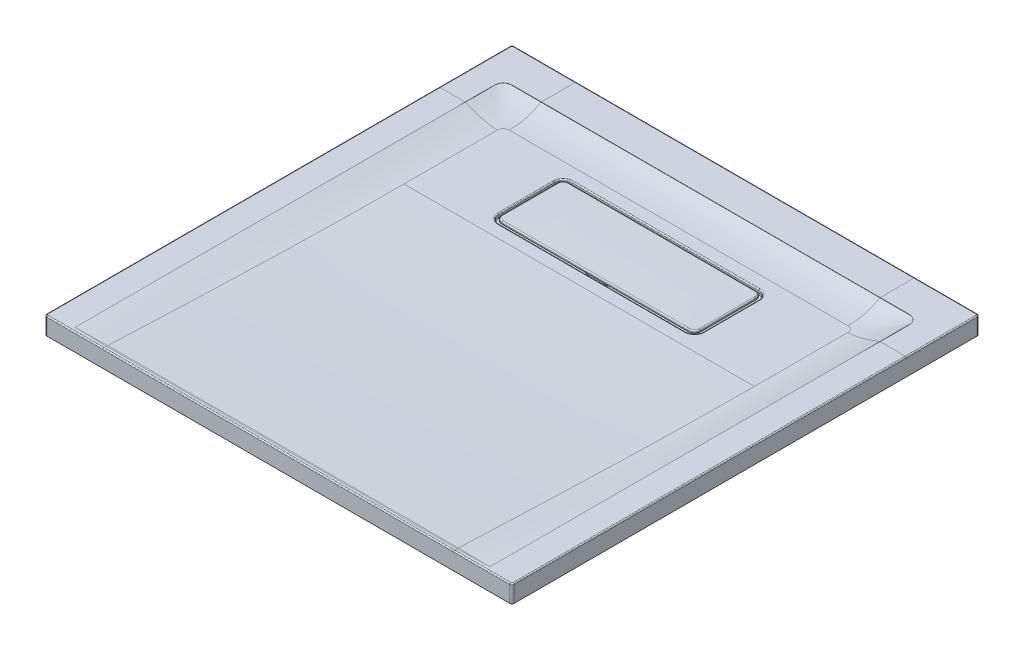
SolidWorks part; units mm, degrees
ref_plane "Płaszczyzna przednia" through (0, 0, 0) normal (0, 0, 1) x (1, 0, 0)
ref_plane "Płaszczyzna górna" through (0, 0, 0) normal (0, 1, 0) x (1, 0, 0)
ref_plane "Płaszczyzna prawa" through (0, 0, 0) normal (1, 0, 0) x (0, 0, -1)
sketch "Szkic1" plane through (0, 0, 0) normal (0, 1, 0) x (1, 0, 0)
  line L0 (0, 200) -> (0, 400) construction
  line L1 (-400, -400) -> (400, -400)
  line L2 (-400, -400) -> (-400, 400)
  line L3 (-400, 400) -> (400, 400)
  line L4 (400, -400) -> (400, 400)
  line L5 (-400, -400) -> (400, 400) construction
  line L6 (-400, 400) -> (400, -400) construction
  line L7 (-160, 137.5) -> (160, 137.5)
  line L8 (-175, 152.5) -> (-175, 247.5)
  line L9 (-160, 262.5) -> (160, 262.5)
  line L10 (175, 152.5) -> (175, 247.5)
  line L11 (-175, 137.5) -> (175, 262.5) construction
  line L12 (-175, 262.5) -> (175, 137.5) construction
  line L13 (-340, 340) -> (340, 340)
  line L14 (355, 325) -> (355, -393)
  line L15 (355, -393) -> (-355, -393)
  line L16 (-355, -393) -> (-355, 325)
  circle A6 centre (0, 200) radius 57.5
  circle A7 centre (0, 200) radius 45
  arc A8 (355, 325) -> (340, 340) centre (340, 325) ccw
  arc A9 (-355, 325) -> (-340, 340) centre (-340, 325) cw
  arc A10 (160, 262.5) -> (175, 247.5) centre (160, 247.5) cw
  arc A11 (175, 152.5) -> (160, 137.5) centre (160, 152.5) cw
  arc A12 (-160, 137.5) -> (-175, 152.5) centre (-160, 152.5) cw
  arc A13 (-175, 247.5) -> (-160, 262.5) centre (-160, 247.5) cw
  point P0 (0, 0)
  point P5 (0, 200)
  dimension "D10" = 115
  dimension "D11" = 90
  dimension "D12" = 15
  dimension "D13" = 15
  dimension "D1" = 800
  dimension "D2" = 800
  dimension "D3" = 200
  dimension "D4" = 125
  dimension "D5" = 350
  dimension "D6" = 60
  dimension "D7" = 45
  dimension "D8" = 45
  dimension "D9" = 7
ref_plane "Płaszczyzna1" through (0, -14, 0) normal (0, 1, 0) x (-1, 0, 0)
ref_plane "korek" through (0, -20.9, 0) normal (0, 1, 0) x (-1, 0, 0)
sketch "Szkic2" plane through (0, 0, 0) normal (0, 1, 0) x (1, 0, 0)
  line L0 (-400, 400) -> (400, 400) construction
  line L1 (-400, -400) -> (-400, 400) construction
  line L2 (-400, -400) -> (400, -400) construction
  line L3 (400, -400) -> (400, 400) construction
  line L5 (355, 325) -> (355, -393) construction
  line L6 (355, -393) -> (-355, -393) construction
  line L7 (-355, -393) -> (-355, 325) construction
  line L8 (-400, 400) -> (400, 400)
  line L9 (-400, -400) -> (-400, 400)
  line L10 (-400, -400) -> (400, -400)
  line L11 (400, -400) -> (400, 400)
  line L12 (-340, 340) -> (340, 340) construction
  line L13 (355, 325) -> (355, -393)
  line L14 (355, -393) -> (-355, -393)
  line L15 (-355, -393) -> (-355, 325)
  line L16 (-340, 340) -> (340, 340)
  arc A0 (355, 325) -> (340, 340) centre (340, 325) ccw construction
  arc A1 (-340, 340) -> (-355, 325) centre (-340, 325) ccw construction
  arc A2 (355, 325) -> (340, 340) centre (340, 325) ccw
  arc A3 (-340, 340) -> (-355, 325) centre (-340, 325) ccw
surface "Powierzchnia-Płaszczyzna1" sketch "Szkic2"
sketch "Szkic3" plane through (0, -14, 0) normal (0, 1, 0) x (-1, 0, 0)
  line L1 (340, -340) -> (-340, -340) construction
  line L2 (-355, -325) -> (-355, 393) construction
  line L3 (-355, 393) -> (355, 393) construction
  line L4 (-175, -152.5) -> (-175, -247.5) construction
  line L5 (160, -262.5) -> (-160, -262.5) construction
  line L6 (175, -152.5) -> (175, -247.5) construction
  line L7 (160, -137.5) -> (-160, -137.5) construction
  line L9 (-300, -115) -> (300, -115)
  line L10 (-300, -115) -> (-300, -275)
  line L11 (-290, -285) -> (290, -285)
  line L12 (300, -115) -> (300, -275)
  line L13 (-300, -115) -> (300, -285) construction
  line L14 (-300, -285) -> (300, -115) construction
  line L16 (355, 393) -> (355, -325) construction
  line L17 (340, -340) -> (-340, -340) construction
  line L18 (-175, -152.5) -> (-175, -247.5)
  line L19 (160, -262.5) -> (-160, -262.5)
  line L20 (175, -152.5) -> (175, -247.5)
  line L21 (160, -137.5) -> (-160, -137.5)
  line L22 (-355, -325) -> (-355, 393) construction
  line L23 (-355, 393) -> (355, 393) construction
  line L24 (355, 393) -> (355, -325) construction
  arc A0 (-175, -247.5) -> (-160, -262.5) centre (-160, -247.5) ccw construction
  arc A1 (160, -262.5) -> (175, -247.5) centre (160, -247.5) ccw construction
  arc A2 (175, -152.5) -> (160, -137.5) centre (160, -152.5) ccw construction
  arc A3 (-160, -137.5) -> (-175, -152.5) centre (-160, -152.5) ccw construction
  arc A4 (-175, -247.5) -> (-160, -262.5) centre (-160, -247.5) ccw
  arc A5 (160, -262.5) -> (175, -247.5) centre (160, -247.5) ccw
  arc A6 (175, -152.5) -> (160, -137.5) centre (160, -152.5) ccw
  arc A7 (-160, -137.5) -> (-175, -152.5) centre (-160, -152.5) ccw
  circle A8 centre (0, -200) radius 45 construction
  circle A9 centre (0, -200) radius 45
  arc A10 (-290, -285) -> (-300, -275) centre (-290, -275) cw
  arc A11 (-355, -325) -> (-340, -340) centre (-340, -325) ccw construction
  arc A12 (340, -340) -> (355, -325) centre (340, -325) ccw construction
  arc A13 (300, -275) -> (290, -285) centre (290, -275) cw
  arc A14 (-355, -325) -> (-340, -340) centre (-340, -325) ccw construction
  arc A15 (340, -340) -> (355, -325) centre (340, -325) ccw construction
  point P26 (0, 0)
  dimension "D3" = 10
  dimension "D4" = 10
  dimension "D1" = 55
  dimension "D2" = 55
surface "Powierzchnia-Płaszczyzna2" sketch "Szkic3"
sketch "Szkic4" plane through (0, 0, 0) normal (0, 1, 0) x (1, 0, 0)
  line L0 (-300, 115) -> (-300, -400)
  line L1 (-400, -400) -> (400, -400) construction
  line L2 (300, 115) -> (300, -400)
  line L3 (300, 115) -> (300, 275) construction
  line L4 (-290, 285) -> (-290, 675)
  line L5 (-300, 275) -> (-690, 275)
  line L6 (290, 285) -> (290, 675)
  line L7 (300, 275) -> (690, 275)
  line L8 (-690, 275) -> (-690, 675) construction
  line L9 (-690, 675) -> (-290, 675) construction
  line L10 (290, 675) -> (690, 675) construction
  line L11 (690, 675) -> (690, 275) construction
  arc A1 (-290, 285) -> (-300, 275) centre (-290, 275) ccw construction
  dimension "D1" = 400
  dimension "D2" = 400
  dimension "D3" = 400
  dimension "D4" = 400
other "Granica-Powierzchnia1"
surface "Powierzchnia-Wyciągnięcie po profilach3"
surface "Powierzchnia-Wyciągnięcie po profilach2"
mirror "Lustro2" about plane through (0, 0, 0) normal (1, 0, 0)
surface "Powierzchnia-Połącz1"
surface "Powierzchnia-Wyciągnięcie po profilach4"
sketch "Szkic5" plane through (0, 0, 0) normal (0, 1, 0) x (1, 0, 0)
  line L0 (-400, -400) -> (-400, 400) construction
  line L1 (-400, 400) -> (400, 400) construction
  line L2 (400, -400) -> (400, 400) construction
  line L3 (-400, -400) -> (400, -400) construction
  line L4 (-400, -400) -> (-400, 400)
  line L5 (-400, 400) -> (400, 400)
  line L6 (400, -400) -> (400, 400)
  line L7 (-400, -400) -> (400, -400)
mirror "Lustro4" about plane through (0, 0, 0) normal (1, 0, 0)
surface "Powierzchnia-Połącz3"
surface "Powierzchnia-Wyciągnięcie1" sketch "Szkic5" parameters "D1"=30
sketch "Szkic6" plane through (0, -14, 0) normal (0, 1, 0) x (-1, 0, 0)
  line L4 (-175, -152.5) -> (-175, -247.5) construction
  line L5 (160, -262.5) -> (-160, -262.5) construction
  line L6 (175, -152.5) -> (175, -247.5) construction
  line L7 (160, -137.5) -> (-160, -137.5) construction
  line L8 (-175, -152.5) -> (-175, -247.5)
  line L9 (160, -262.5) -> (-160, -262.5)
  line L10 (175, -152.5) -> (175, -247.5)
  line L11 (160, -137.5) -> (-160, -137.5)
  arc A0 (-175, -247.5) -> (-160, -262.5) centre (-160, -247.5) ccw construction
  arc A1 (160, -262.5) -> (175, -247.5) centre (160, -247.5) ccw construction
  arc A2 (175, -152.5) -> (160, -137.5) centre (160, -152.5) ccw construction
  arc A3 (-160, -137.5) -> (-175, -152.5) centre (-160, -152.5) ccw construction
  arc A4 (-175, -247.5) -> (-160, -262.5) centre (-160, -247.5) ccw
  arc A5 (160, -262.5) -> (175, -247.5) centre (160, -247.5) ccw
  arc A6 (175, -152.5) -> (160, -137.5) centre (160, -152.5) ccw
  arc A7 (-160, -137.5) -> (-175, -152.5) centre (-160, -152.5) ccw
surface "Powierzchnia-Wyciągnięcie2" sketch "Szkic6"
sketch "Szkic8" plane through (0, 0, 0) normal (1, 0, 0) x (0, 0, -1)
  line L0 (200, 0) -> (200, -30) construction
  line L1 (400, -30) -> (-400, -30) construction
  line L2 (245, -30) -> (245, -28)
  line L3 (245, -28) -> (257.615, -20.9)
  line L4 (200, -30) -> (245, -30) construction
  line L5 (257.615, -20.9) -> (450, -20.9)
  dimension "D1" = 45
  dimension "D2" = 2
  dimension "D3" = 115.23
  dimension "D4" = 20.9
  dimension "D5" = 250
surface "Powierzchnia-Obrót1" sketch "Szkic8" parameters "D1"=360
surface "Powierzchnia-Przytnij1"
surface "Powierzchnia-Płaszczyzna3"
surface "Powierzchnia-Połącz4"
fillet "Zaokrąglenie1" radius 4 4 edges at (-400, -15, 400) (-400, -15, -400) (400, -15, -400) (400, -15, 400)
fillet "Zaokrąglenie2" radius 2 22 edges at (-400, 0, -335.5) (-398.8284, 0, -398.8284) (-343, 0, -400) (0, 0, -400) (343, 0, -400) (398.8284, 0, -398.8284) (400, 0, -335.5) (400, 0, 60.5) (398.8284, 0, 398.8284) (348, 0, 400) (-348, 0, 400) (0, 0, 400) (-398.8284, 0, 398.8284) (-400, 0, 60.5) (-170.6066, -14, -258.1066) (-175, -14, -200) (-170.6066, -14, -141.8934) (0, -14, -137.5) (170.6066, -14, -141.8934) (175, -14, -200) (170.6066, -14, -258.1066) (0, -14, -262.5)
fillet "Zaokrąglenie3" radius 1 8 edges at (0, -20.9, -262.5) (170.6066, -20.9, -258.1066) (175, -20.9, -200) (170.6066, -20.9, -141.8934) (0, -20.9, -137.5) (-170.6066, -20.9, -141.8934) (-175, -20.9, -200) (-170.6066, -20.9, -258.1066)
fillet "Zaokrąglenie4" radius 1 9 edges
fillet "Zaokrąglenie5" radius 1 2 edges at (0, -28, -245) (0, -20.9, -257.615)
fillet "Zaokrąglenie6" radius 55 3 edges
ref_plane "Płaszczyzna2" through (0, -17, 0) normal (0, 1, 0) x (-1, 0, 0)
sketch "Szkic9" plane through (0, -17, 0) normal (0, 1, 0) x (-1, 0, 0)
  line L1 (-160, -142.5) -> (160, -142.5)
  line L2 (-170, -152.5) -> (-170, -247.5)
  line L3 (-160, -257.5) -> (160, -257.5)
  line L4 (170, -152.5) -> (170, -247.5)
  line L5 (-170, -142.5) -> (170, -257.5) construction
  line L6 (-170, -257.5) -> (170, -142.5) construction
  arc A0 (160, -142.5) -> (170, -152.5) centre (160, -152.5) cw
  arc A1 (170, -247.5) -> (160, -257.5) centre (160, -247.5) cw
  arc A2 (-160, -257.5) -> (-170, -247.5) centre (-160, -247.5) cw
  arc A3 (-170, -152.5) -> (-160, -142.5) centre (-160, -152.5) cw
  point P0 (0, -200)
  dimension "D3" = 10
  dimension "D1" = 340
  dimension "D2" = 115
extrude "Dodanie-wyciągnięcie1" add sketch "Szkic9" along normal blind 4 separate body
sketch "Szkic10" plane through (0, 0, 0) normal (1, 0, 0) x (0, 0, -1)
  line L0 (200, -13) -> (200, -12) construction
  line L1 (152.5, -13) -> (247.5, -13) construction
  arc A0 (200, -12) -> (142.5, -13) centre (200, -1665.625) ccw
  arc A1 (200, -12) -> (257.5, -13) centre (200, -1665.625) cw
  dimension "D1" = 1
ref_plane "Płaszczyzna3" through (0, 0, -200) normal (0, 0, -1) x (-1, 0, 0)
sketch "Szkic11" plane through (0, 0, -200) normal (0, 0, -1) x (-1, 0, 0)
  line L0 (0, -13) -> (0, -12) construction
  line L1 (-160, -13) -> (160, -13) construction
  arc A0 (0, -12) -> (-170, -13) centre (0, -14462.5) ccw
  arc A1 (0, -12) -> (170, -13) centre (0, -14462.5) cw
  dimension "D1" = 1
other "Usuń ścianę1"
surface "Powierzchnia-wypełnij1"
surface "Powierzchnia-Połącz5"
fillet "Zaokrąglenie7" radius 2 8 edges
